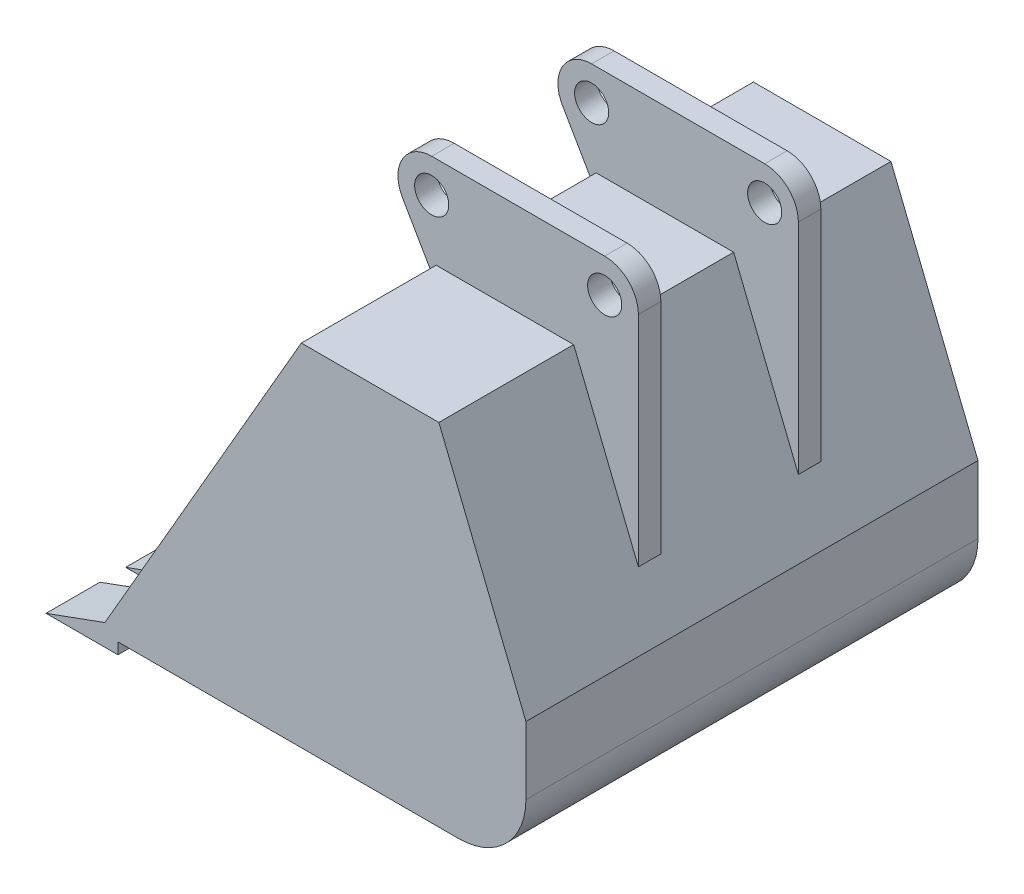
SolidWorks part; units mm, degrees
ref_plane "Front Plane" through (0, 0, 0) normal (0, 0, 1) x (1, 0, 0)
ref_plane "Top Plane" through (0, 0, 0) normal (0, 1, 0) x (1, 0, 0)
ref_plane "Right Plane" through (0, 0, 0) normal (1, 0, 0) x (0, 0, -1)
sketch "Sketch1" plane through (0, 0, 0) normal (0, 0, 1) x (1, 0, 0)
  line L0 (0, -150) -> (-758, -150)
  line L1 (-758, -150) -> (-758, -175)
  line L2 (-758, -175) -> (-918, -175)
  line L3 (-918, -175) -> (-786.9996, -127.3197)
  line L4 (-786.9996, -127.3197) -> (-349.7608, 630)
  line L5 (-349.7608, 630) -> (-43.7608, 630)
  line L6 (-43.7608, 630) -> (150, 150.4252)
  line L7 (150, 150.4252) -> (150, 0)
  line L8 (-460.793, 835) -> (-24.8281, 835) construction
  line L9 (0, -110) -> (-777, -110) construction
  line L10 (0, -110) -> (-758, -110) construction
  arc A0 (0, -150) -> (150, 0) centre (0, 0) ccw
  dimension "D1" = 300
  dimension "D2" = 758
  dimension "D3" = 1068
  dimension "D4" = 985
  dimension "D5" = 780
  dimension "D6" = 1010
  dimension "D7" = 60
  dimension "D8" = 20
  dimension "D9" = 306
  dimension "D11" = 141
  dimension "D12" = 68
  dimension "D10" = 40
extrude "Boss-Extrude1" add sketch "Sketch1" along normal mid plane 1006
sketch "Sketch3" plane through (0, 0, 503) normal (0, 0, 1) x (1, 0, 0)
  line L0 (-349.7608, 630) -> (-786.9996, -127.3197) construction
  line L1 (-372.8548, 590) -> (-777, -110)
  line L36 (110, 0) -> (110, 142.65)
  line L37 (110, 142.65) -> (-70.7411, 590)
  line L38 (-70.7411, 590) -> (-326.6668, 590)
  line L39 (-326.6668, 590) -> (-730.812, -110)
  line L40 (-730.812, -110) -> (0, -110)
  line L41 (110, 0) -> (110, 142.65)
  line L42 (110, 142.65) -> (-70.7411, 590)
  line L43 (-70.7411, 590) -> (-372.8548, 590)
  line L45 (-777, -110) -> (0, -110)
  arc A6 (0, -110) -> (110, 0) centre (0, 0) ccw
  arc A7 (0, -110) -> (110, 0) centre (0, 0) ccw
  point P0 (-372.8548, 590)
  dimension "D1" = 40
extrude "Cut-Extrude1" cut sketch "Sketch3" against normal mid plane 926 from offset 503
sketch "Sketch4" plane through (0, 0, 0) normal (0, 0, 1) x (1, 0, 0)
  line L0 (100.2392, 273.5875) -> (100.2392, 760)
  line L1 (150, 150.4252) -> (-43.7608, 630) construction
  line L2 (25.2392, 835) -> (-359.7608, 835)
  line L3 (-424.7127, 722.5) -> (-360.5343, 611.3397)
  line L4 (-349.7608, 630) -> (-786.9996, -127.3197) construction
  line L5 (-758, -150) -> (0, -150) construction
  line L6 (-43.7608, 630) -> (-349.7608, 630) construction
  line L7 (100.2392, 273.5875) -> (-43.7608, 630)
  line L8 (-349.7608, 630) -> (-360.5343, 611.3397)
  line L9 (-43.7608, 630) -> (-349.7608, 630)
  arc A0 (100.2392, 760) -> (25.2392, 835) centre (25.2392, 760) ccw
  arc A1 (-359.7608, 835) -> (-424.7127, 722.5) centre (-359.7608, 760) ccw
  circle A2 centre (-359.7608, 760) radius 38
  circle A3 centre (25.2392, 760) radius 38
  dimension "D1" = 75
  dimension "D2" = 75
  dimension "D7" = 76
  dimension "D8" = 76
  dimension "D3" = 910
  dimension "D4" = 120
  dimension "D5" = 385
  dimension "D6" = 144
extrude "Boss-Extrude2" add sketch "Sketch4" along normal blind 50 from offset 153
mirror "Mirror1" about plane through (0, 0, 0) normal (0, 0, 1) of "Boss-Extrude2"
sketch "Sketch5" plane through (0, -110, 0) normal (0, 1, 0) x (1, 0, 0)
  line L0 (-786.9996, -503) -> (-786.9996, 503) construction
  line L1 (-786.9996, 383) -> (-918, 383)
  line L2 (-786.9996, 383) -> (-786.9996, 325.8)
  line L3 (-786.9996, 325.8) -> (-918, 325.8)
  line L4 (-918, 383) -> (-918, 325.8)
  line L5 (-918, -503) -> (-918, 503) construction
  line L6 (-786.9996, 503) -> (-918, 503) construction
  line L7 (-786.9996, 205.8) -> (-786.9996, 148.6)
  line L8 (-786.9996, 205.8) -> (-918, 205.8)
  line L9 (-918, 205.8) -> (-918, 148.6)
  line L10 (-786.9996, 148.6) -> (-918, 148.6)
  line L11 (-786.9996, 28.6) -> (-786.9996, -28.6)
  line L12 (-786.9996, 28.6) -> (-918, 28.6)
  line L13 (-918, 28.6) -> (-918, -28.6)
  line L14 (-786.9996, -28.6) -> (-918, -28.6)
  line L15 (-786.9996, -148.6) -> (-786.9996, -205.8)
  line L16 (-786.9996, -148.6) -> (-918, -148.6)
  line L17 (-918, -148.6) -> (-918, -205.8)
  line L18 (-786.9996, -205.8) -> (-918, -205.8)
  line L19 (-786.9996, -325.8) -> (-786.9996, -383)
  line L20 (-786.9996, -325.8) -> (-918, -325.8)
  line L21 (-918, -325.8) -> (-918, -383)
  line L22 (-786.9996, -383) -> (-918, -383)
  dimension "D1" = 120
  dimension "D2" = 57.2
  dimension "D4" = 120
  dimension "D3" = 5
extrude "Cut-Extrude2" cut sketch "Sketch5" against normal through all
